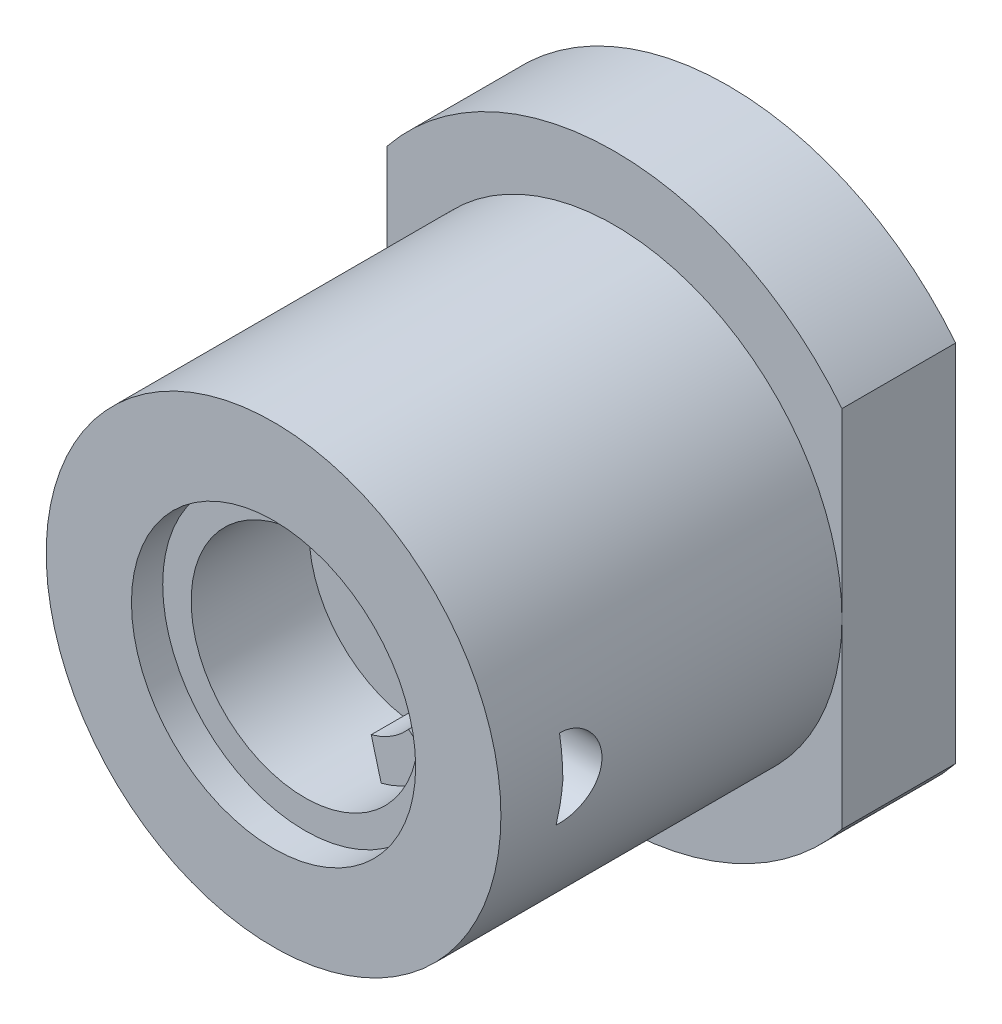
SolidWorks part; units mm, degrees
ref_plane "Plan de face" through (0, 0, 0) normal (0, 0, 1) x (1, 0, 0)
ref_plane "Plan de dessus" through (0, 0, 0) normal (0, 1, 0) x (1, 0, 0)
ref_plane "Plan de droite" through (0, 0, 0) normal (1, 0, 0) x (0, 0, -1)
sketch "Esquisse1" plane through (0, 0, 0) normal (0, 0, 1) x (1, 0, 0)
  circle A0 centre (0, 0) radius 16
  dimension "D1" = 32
extrude "Extrusion1" add sketch "Esquisse1" along normal blind 24
sketch "Esquisse2" plane through (0, 0, 0) normal (0, 0, -1) x (-1, 0, 0)
  circle A0 centre (0, 0) radius 20.5
  dimension "D1" = 41
extrude "Extrusion2" add sketch "Esquisse2" along normal blind 8
sketch "Esquisse3" plane through (0, 0, -8) normal (0, 0, -1) x (-1, 0, 0)
  line L0 (-16, 12.816) -> (-16, -12.816)
  line L1 (0, 0) -> (0, 20.2049) construction
  line L2 (16, 12.816) -> (16, -12.816)
  circle A0 centre (0, 0) radius 20.5 construction
  arc A1 (-16, -12.816) -> (-16, 12.816) centre (0, 0) cw
  arc A2 (16, -12.816) -> (16, 12.816) centre (0, 0) ccw
  dimension "D1" = 16
extrude "Enlèv. mat.-Extru.1" cut sketch "Esquisse3" against normal blind 8
sketch "Esquisse4" plane through (0, 0, 24) normal (0, 0, 1) x (1, 0, 0)
  line L1 (0, 0) -> (57.7669, 14.4293) construction
  line L3 (0, 0) -> (35.941, -47.6526) construction
  line L8 (0, 0) -> (54.3928, -7.6205) construction
  dimension "D1" = 45
  dimension "D4" = 22
extrude "A modifier" cut sketch "Esquisse4" against normal blind 4.36
sketch "Esquisse5" plane through (0, 0, 24) normal (0, 0, 1) x (1, 0, 0)
  circle A0 centre (0, 0) radius 10
  dimension "D1" = 20
extrude "Enlèv. mat.-Extru.3" cut sketch "Esquisse5" against normal blind 2.2
sketch "Esquisse6" plane through (0, 0, 24) normal (0, 0, 1) x (1, 0, 0)
  circle A0 centre (0, 0) radius 8
  dimension "D1" = 16
extrude "Enlèv. mat.-Extru.4" cut sketch "Esquisse6" against normal blind 10.5
sketch "Esquisse7" plane through (0, 0, 13.5) normal (0, 0, 1) x (1, 0, 0)
  line L2 (2.0739, -7.7265) -> (1.3739, -5.1188)
  line L3 (4.0015, -3.4754) -> (6.0399, -5.2459)
  arc A2 (2.0739, -7.7265) -> (6.0399, -5.2459) centre (0, 0) ccw
  arc A3 (1.3739, -5.1188) -> (4.0015, -3.4754) centre (0, 0) ccw
extrude "Extrusion3" add sketch "Esquisse7" along normal blind 5
sketch "Esquisse8" plane through (0, 0, 0) normal (0, 1, 0) x (1, 0, 0)
  line L1 (16, -19.64) -> (10, -19.64)
  line L2 (16, -19.64) -> (16, -16.89)
  line L3 (16, -16.89) -> (12.74, -16.89)
  line L4 (10, -19.64) -> (10, -19.63)
  line L7 (9.0743, -19.64) -> (19.3993, -19.64) construction
  arc A0 (10, -19.63) -> (12.74, -16.89) centre (12.74, -19.63) cw
  dimension "D2" = 2.74
  dimension "D1" = 2.75
  dimension "D3" = 6
revolve "Enlèvement de matière-Révolution1" cut sketch "Esquisse8" angle 90 about L7
sketch "Esquisse9" plane through (0, 0, 0) normal (0, 1, 0) x (1, 0, 0)
  line L4 (7.2289, -14.517) -> (10.2335, -19.7211)
  line L5 (10.2335, -19.7211) -> (11.3333, -18.6213)
  line L6 (11.3333, -18.6213) -> (7.2289, -14.517)
revolve "Enlèvement de matière-Révolution3" cut sketch "Esquisse9" angle 360 about L6
